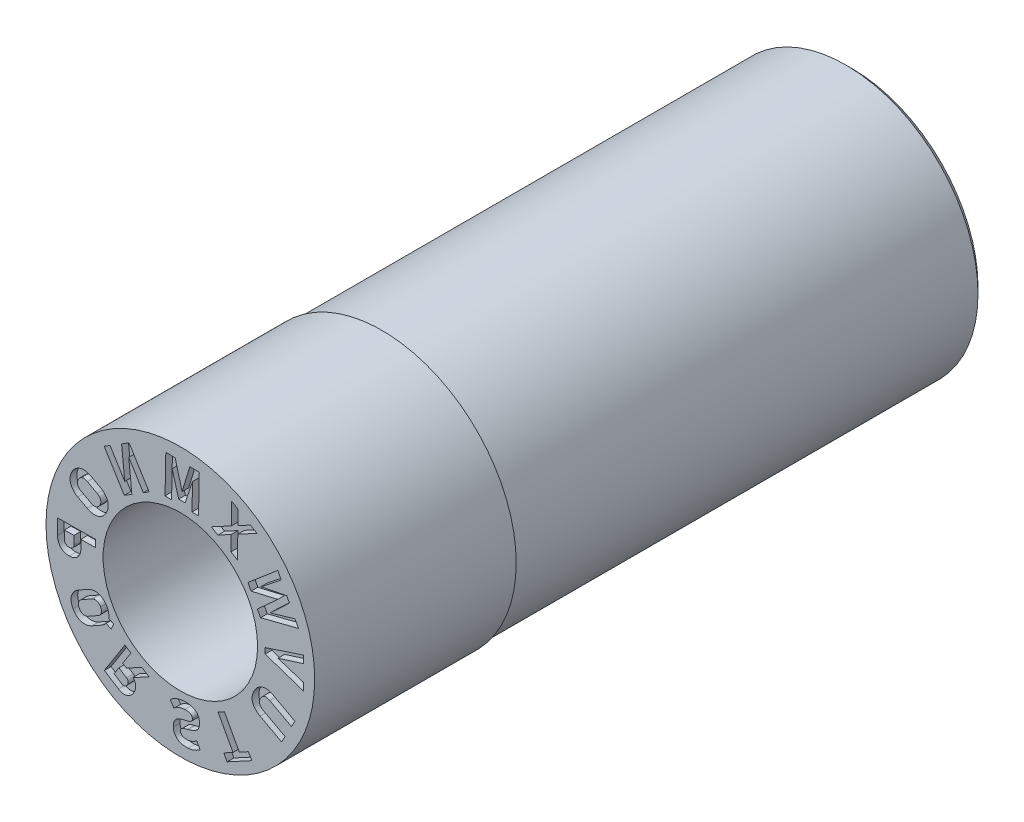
SolidWorks part; units mm, degrees
ref_plane "Front Plane" through (0, 0, 0) normal (0, 0, 1) x (1, 0, 0)
ref_plane "Top Plane" through (0, 0, 0) normal (0, 1, 0) x (1, 0, 0)
ref_plane "Right Plane" through (0, 0, 0) normal (1, 0, 0) x (0, 0, -1)
sketch "Sketch1" plane through (0, 0, 0) normal (1, 0, 0) x (0, 0, -1)
  line L2 (0, 4) -> (0, 2.3)
  line L3 (19.75, 4) -> (0, 4)
  line L4 (-3.7979, 0) -> (49996.2021, 0) construction
  line L8 (16, 1.25) -> (4, 1.25)
  line L9 (4, 2.3) -> (4, 1.25)
  line L10 (4, 2.3) -> (0, 2.3)
  line L12 (20, 2) -> (20, 3.75)
  line L16 (20, 3.75) -> (19.75, 4)
  line L17 (20, 2) -> (16, 2)
  line L18 (16, 1.25) -> (16, 2)
  dimension "D1" = 20
  dimension "D2" = 45
  dimension "D3" = 0.25
  dimension "D4" = 8
  dimension "D5" = 4.6
  dimension "D6" = 4
  dimension "D7" = 2.5
  dimension "D8" = 4
  dimension "D9" = 4
revolve "Revolve1" add sketch "Sketch1" angle 360 about L4
sketch "Sketch4" plane through (0, 0, 0) normal (1, 0, 0) x (0, 0, -1)
  line L0 (0, 0) -> (50000, 0) construction
  line L1 (20, -3.75) -> (20, 3.75) construction
  line L2 (6, 4.935) -> (20, 4.935)
  line L3 (6, 4.935) -> (6, 3.935)
  line L4 (6, 3.935) -> (20, 3.935)
  line L5 (20, 4.935) -> (20, 3.935)
  line L6 (19.75, 4) -> (0, 4) construction
  line L9 (0, 4.4) -> (0, -4.4) construction
  dimension "D1" = 1
  dimension "D2" = 0.065
  dimension "D3" = 6
revolve "Cut-Revolve1" cut sketch "Sketch4" angle 360 about L0
sketch "Sketch2" plane through (0, 0, 0) normal (0, 0, 1) x (1, 0, 0)
  line L0 (0, 0) -> (0, 4) construction
  line L1 (0, 0) -> (2, 3.4641) construction
  line L2 (0, 0) -> (3.4641, 2) construction
  line L3 (0, 0) -> (4, 0) construction
  line L4 (0, 0) -> (3.4641, -2) construction
  line L5 (0, 0) -> (2, -3.4641) construction
  line L6 (0, 0) -> (0, -4) construction
  line L7 (0, 0) -> (-2, -3.4641) construction
  line L8 (0, 0) -> (-3.4641, -2) construction
  line L9 (0, 0) -> (-4, 0) construction
  line L10 (0, 0) -> (-3.4641, 2) construction
  line L11 (0, 0) -> (-2, 3.4641) construction
  line L12 (3.2478, 1.5887) -> (3.169, 1.7412)
  line L13 (3.169, 1.7412) -> (2.3975, 1.5864)
  line L14 (2.3975, 1.5864) -> (3.0025, 2.0634)
  line L15 (3.0025, 2.0634) -> (2.9015, 2.2588)
  line L16 (2.9015, 2.2588) -> (2.014, 1.5057)
  line L17 (2.014, 1.5057) -> (2.1065, 1.327)
  line L18 (2.1065, 1.327) -> (2.9029, 1.5121)
  line L19 (2.9029, 1.5121) -> (2.2957, 0.9612)
  line L20 (2.2957, 0.9612) -> (2.3881, 0.7825)
  line L21 (2.3881, 0.7825) -> (3.5154, 1.0711)
  line L22 (3.5154, 1.0711) -> (3.4144, 1.2665)
  line L23 (3.4144, 1.2665) -> (2.6753, 1.0486)
  line L24 (2.6753, 1.0486) -> (3.2478, 1.5887)
  line L26 (1.7103, 2.5972) -> (2.2805, 2.9042)
  line L27 (2.2805, 2.9042) -> (2.0873, 3.0209)
  line L28 (2.0873, 3.0209) -> (1.7131, 2.8193)
  line L31 (0.9233, 2.3945) -> (1.1171, 2.2779)
  line L32 (1.1171, 2.2779) -> (1.514, 2.4918)
  line L33 (1.7131, 2.8193) -> (1.7187, 3.243)
  line L34 (1.7187, 3.243) -> (1.525, 3.3596)
  line L35 (1.525, 3.3596) -> (1.5168, 2.7134)
  line L36 (1.514, 2.4918) -> (1.5083, 2.0421)
  line L37 (1.5083, 2.0421) -> (1.7019, 1.9254)
  line L38 (1.7019, 1.9254) -> (1.7103, 2.5972)
  line L39 (-0.151, 3.6336) -> (-0.4332, 3.6392)
  line L40 (-0.4332, 3.6392) -> (-0.4552, 2.5035)
  line L41 (-0.4552, 2.5035) -> (-0.2606, 2.4998)
  line L42 (-0.2606, 2.4998) -> (-0.2449, 3.3057)
  line L43 (-2.964, 0.1283) -> (-2.5234, 0.132)
  line L44 (-0.2449, 3.3057) -> (-0.0488, 2.6222)
  line L45 (-0.0488, 2.6222) -> (0.1403, 2.6185)
  line L46 (0.1403, 2.6185) -> (0.3626, 3.2806)
  line L47 (-3.4528, 0.1243) -> (-3.1702, 0.1266)
  line L48 (0.3626, 3.2806) -> (0.3472, 2.4879)
  line L49 (0.3472, 2.4879) -> (0.5417, 2.4842)
  line L50 (0.5417, 2.4842) -> (0.5637, 3.62)
  line L51 (0.5637, 3.62) -> (0.2818, 3.6253)
  line L52 (0.2818, 3.6253) -> (0.0506, 2.8642)
  line L53 (0.0506, 2.8642) -> (-0.151, 3.6336)
  line L54 (-1.5278, 3.3341) -> (-1.7503, 3.1959)
  line L55 (-1.7503, 3.1959) -> (-1.6547, 2.2765)
  line L56 (-1.7164, -2.4432) -> (-1.4707, -2.0578)
  line L57 (-1.6547, 2.2765) -> (-2.0934, 2.9829)
  line L58 (-2.0934, 2.9829) -> (-2.2675, 2.8748)
  line L59 (-2.2675, 2.8748) -> (-1.6685, 1.9102)
  line L60 (-1.6685, 1.9102) -> (-1.4448, 2.0493)
  line L61 (-1.4448, 2.0493) -> (-1.5349, 2.9576)
  line L62 (-1.6068, -2.5131) -> (-1.7164, -2.4432)
  line L63 (-1.5349, 2.9576) -> (-1.1026, 2.2615)
  line L64 (-1.1026, 2.2615) -> (-0.9288, 2.3694)
  line L65 (-0.9288, 2.3694) -> (-1.5278, 3.3341)
  line L66 (-2.3769, 1.7535) -> (-2.66, 1.9063)
  line L67 (-3.054, 1.1763) -> (-2.7709, 1.0234)
  line L68 (-2.6606, 1.2161) -> (-2.9535, 1.3742)
  line L69 (-2.7701, 1.7138) -> (-2.4772, 1.5557)
  line L70 (-3.1702, 0.1266) -> (-3.1682, -0.1202)
  line L71 (-3.4508, -0.1224) -> (-3.4528, 0.1243)
  line L72 (1.5674, -3.1018) -> (1.2946, -3.2497)
  line L73 (-3.6609, 0.3367) -> (-3.6571, -0.1188)
  line L74 (-2.9621, -0.113) -> (-2.964, 0.1283)
  line L75 (1.5168, 2.7134) -> (0.9233, 2.3945)
  line L78 (-2.5234, 0.132) -> (-2.5252, 0.3461)
  line L79 (-2.5252, 0.3461) -> (-3.6609, 0.3367)
  line L81 (-2.211, -1.664) -> (-2.0551, -1.7316)
  line L82 (-2.0551, -1.7316) -> (-1.9848, -1.5618)
  line L83 (-1.9848, -1.5618) -> (-2.1336, -1.4974)
  line L84 (-2.7543, -1.0586) -> (-3.0335, -1.2159)
  line L85 (-2.6283, -1.9351) -> (-2.3491, -1.7779)
  line L86 (-2.4529, -1.5827) -> (-2.7413, -1.7452)
  line L87 (-2.9297, -1.4107) -> (-2.6414, -1.2482)
  line L88 (-1.8273, -2.6171) -> (-1.6027, -2.7604)
  line L89 (-1.7464, -2.9858) -> (-1.971, -2.8425)
  line L91 (-2.2626, -2.9016) -> (-1.8429, -3.1691)
  line L95 (-1.971, -2.8425) -> (-1.8273, -2.6171)
  line L96 (-1.4707, -2.0578) -> (-1.6512, -1.9428)
  line L97 (-1.6512, -1.9428) -> (-2.2626, -2.9016)
  line L99 (-1.4072, -2.6539) -> (-0.9263, -2.4049)
  line L100 (-0.9263, -2.4049) -> (-1.1452, -2.2654)
  line L101 (-1.1452, -2.2654) -> (-1.6068, -2.5131)
  line L102 (-0.3006, -2.6698) -> (-0.1912, -2.8404)
  line L103 (0.358, -2.8323) -> (0.358, -2.833)
  line L104 (0.1582, -2.98) -> (0.1411, -2.9834)
  line L105 (-0.2083, -3.3355) -> (-0.2082, -3.3364)
  line L106 (0.588, -3.5207) -> (0.487, -3.3448)
  line L107 (0.0053, -3.3443) -> (0.0053, -3.3436)
  line L108 (0.5706, -2.8257) -> (0.5707, -2.824)
  line L110 (1.756, -2.9995) -> (1.3119, -2.1801)
  line L111 (1.3119, -2.1801) -> (1.1233, -2.2823)
  line L112 (1.1233, -2.2823) -> (1.5674, -3.1018)
  line L113 (1.3931, -3.4315) -> (2.1273, -3.0336)
  line L114 (2.1273, -3.0336) -> (2.0287, -2.8518)
  line L115 (2.0287, -2.8518) -> (1.756, -2.9995)
  line L116 (1.2946, -3.2497) -> (1.3931, -3.4315)
  line L117 (2.3753, -1.7607) -> (3.0147, -2.1065)
  line L118 (3.0147, -2.1065) -> (3.1167, -1.9178)
  line L119 (3.1167, -1.9178) -> (2.4724, -1.5694)
  line L120 (2.664, -1.2153) -> (3.3083, -1.5638)
  line L121 (3.3083, -1.5638) -> (3.4104, -1.3751)
  line L122 (3.4104, -1.3751) -> (2.771, -1.0292)
  line L123 (3.6619, -0.4666) -> (3.6626, -0.2463)
  line L124 (3.6626, -0.2463) -> (2.9056, -0.0029)
  line L125 (2.9056, -0.0029) -> (3.6637, 0.2363)
  line L126 (3.6637, 0.2363) -> (3.6644, 0.4566)
  line L127 (3.6644, 0.4566) -> (2.5277, 0.0818)
  line L128 (2.5277, 0.0818) -> (2.5272, -0.0855)
  line L129 (2.5272, -0.0855) -> (3.6619, -0.4666)
  circle A0 centre (0, 0) radius 2.5697 construction
  circle A1 centre (0, 0) radius 4 construction
  spline S0 degree 3 poles (-2.2052, 1.1896) (-2.1958, 1.2073) (-2.1831, 1.2341) (-2.1695, 1.2707) (-2.1614, 1.2977) (-2.1551, 1.3248) (-2.1506, 1.3518) (-2.1479, 1.3788) (-2.1474, 1.4057) (-2.1485, 1.4323) (-2.1514, 1.4584) (-2.1562, 1.484) (-2.1629, 1.509) (-2.1713, 1.5336) (-2.1814, 1.5576) (-2.1935, 1.5811) (-2.2074, 1.6039) (-2.223, 1.6261) (-2.2402, 1.6472) (-2.259, 1.6674) (-2.2794, 1.6867) (-2.3014, 1.7051) (-2.3335, 1.7281) (-2.3591, 1.7438) (-2.3769, 1.7535) knots 0 0 0 0 0.090475 0.133833 0.176138 0.218046 0.259239 0.299899 0.340503 0.38067 0.420105 0.459006 0.497913 0.537136 0.576103 0.615708 0.656162 0.696964 0.737956 0.779326 0.821594 0.864592 0.908608 1 1 1 1
  spline S1 degree 3 poles (-2.66, 1.9063) (-2.6778, 1.916) (-2.7049, 1.929) (-2.742, 1.9425) (-2.7693, 1.951) (-2.7966, 1.9575) (-2.8238, 1.9622) (-2.8509, 1.965) (-2.8779, 1.9657) (-2.9046, 1.9649) (-2.9308, 1.9619) (-2.9565, 1.9571) (-2.9817, 1.9511) (-3.0062, 1.9426) (-3.0303, 1.9327) (-3.0538, 1.9209) (-3.0766, 1.9073) (-3.0987, 1.8921) (-3.1198, 1.8751) (-3.1401, 1.8567) (-3.159, 1.8363) (-3.1772, 1.8148) (-3.2005, 1.7834) (-3.2156, 1.7578) (-3.2253, 1.7404) knots 0 0 0 0 0.091587 0.13545 0.17853 0.220707 0.262153 0.303049 0.343867 0.384229 0.42368 0.463053 0.50187 0.540771 0.580159 0.619472 0.659607 0.700066 0.740693 0.782021 0.823629 0.866209 0.909671 1 1 1 1
  spline S2 degree 3 poles (-3.2253, 1.7404) (-3.2347, 1.7227) (-3.2475, 1.6959) (-3.2609, 1.6592) (-3.2694, 1.6323) (-3.2754, 1.6051) (-3.2799, 1.5782) (-3.2826, 1.5512) (-3.2831, 1.5243) (-3.282, 1.4977) (-3.279, 1.4715) (-3.2745, 1.4458) (-3.2676, 1.4208) (-3.2594, 1.3962) (-3.2492, 1.3722) (-3.2371, 1.3487) (-3.2233, 1.3259) (-3.2077, 1.3038) (-3.1905, 1.2826) (-3.1716, 1.2625) (-3.1516, 1.2429) (-3.1292, 1.225) (-3.0975, 1.2015) (-3.0718, 1.186) (-3.054, 1.1763) knots 0 0 0 0 0.090473 0.133829 0.1764 0.218055 0.259247 0.299906 0.340509 0.380675 0.420108 0.459465 0.49837 0.537255 0.576563 0.616167 0.656272 0.697072 0.738063 0.779432 0.82162 0.86472 0.908611 1 1 1 1
  spline S3 degree 3 poles (-2.7709, 1.0234) (-2.7531, 1.0138) (-2.726, 1.0008) (-2.6889, 0.9872) (-2.6616, 0.9788) (-2.6343, 0.9723) (-2.6071, 0.9675) (-2.5799, 0.9649) (-2.5528, 0.9641) (-2.5261, 0.9651) (-2.4998, 0.9678) (-2.4741, 0.9725) (-2.449, 0.9789) (-2.4243, 0.987) (-2.4003, 0.9973) (-2.3768, 1.009) (-2.3539, 1.0227) (-2.3318, 1.038) (-2.3107, 1.0549) (-2.2905, 1.0734) (-2.2713, 1.0934) (-2.2534, 1.1153) (-2.2299, 1.1466) (-2.215, 1.1722) (-2.2052, 1.1896) knots 0 0 0 0 0.091523 0.135355 0.178405 0.220553 0.26197 0.303107 0.343897 0.384231 0.423812 0.463158 0.501833 0.541132 0.580087 0.619718 0.659825 0.700256 0.740854 0.782153 0.823651 0.866303 0.909734 1 1 1 1
  spline S4 degree 3 poles (-2.3937, 1.2914) (-2.4023, 1.2753) (-2.4175, 1.253) (-2.4429, 1.2283) (-2.4632, 1.2133) (-2.4851, 1.2015) (-2.5081, 1.193) (-2.5323, 1.1882) (-2.5573, 1.1867) (-2.5831, 1.1888) (-2.6186, 1.1962) (-2.6441, 1.2072) (-2.6606, 1.2161) knots 0 0 0 0 0.175119 0.257326 0.338171 0.416955 0.495278 0.572703 0.652986 0.735347 0.820181 1 1 1 1
  spline S5 degree 3 poles (-2.9535, 1.3742) (-2.9702, 1.3828) (-2.993, 1.3986) (-3.0188, 1.4239) (-3.0347, 1.4443) (-3.0474, 1.4661) (-3.0565, 1.4891) (-3.0626, 1.513) (-3.0644, 1.5377) (-3.0631, 1.5629) (-3.0562, 1.5976) (-3.0458, 1.6226) (-3.0372, 1.6387) knots 0 0 0 0 0.179549 0.264319 0.346737 0.426788 0.505309 0.58302 0.662167 0.742098 0.824788 1 1 1 1
  spline S6 degree 3 poles (-3.0372, 1.6387) (-3.0283, 1.6545) (-3.0135, 1.6771) (-2.9882, 1.7016) (-2.9678, 1.7166) (-2.946, 1.7286) (-2.9228, 1.7367) (-2.8985, 1.7417) (-2.8734, 1.7431) (-2.8477, 1.7411) (-2.8123, 1.7333) (-2.7866, 1.7227) (-2.7701, 1.7138) knots 0 0 0 0 0.17437 0.256578 0.337423 0.416207 0.494702 0.572815 0.653099 0.73546 0.819773 1 1 1 1
  spline S7 degree 3 poles (-2.4772, 1.5557) (-2.4605, 1.547) (-2.4378, 1.5312) (-2.4118, 1.5059) (-2.396, 1.4855) (-2.3832, 1.4638) (-2.3744, 1.4407) (-2.3685, 1.4169) (-2.3667, 1.3922) (-2.3677, 1.3669) (-2.3747, 1.3323) (-2.385, 1.3073) (-2.3937, 1.2914) knots 0 0 0 0 0.180401 0.264533 0.347036 0.427169 0.505921 0.583014 0.662241 0.742853 0.825627 1 1 1 1
  spline S8 degree 3 poles (-3.1682, -0.1202) (-3.168, -0.1324) (-3.1699, -0.1503) (-3.177, -0.1728) (-3.1849, -0.188) (-3.1942, -0.2021) (-3.2059, -0.2145) (-3.2191, -0.2255) (-3.2344, -0.2344) (-3.2508, -0.242) (-3.2753, -0.2488) (-3.2945, -0.2513) (-3.3077, -0.251) knots 0 0 0 0 0.169702 0.249373 0.32835 0.407202 0.484869 0.56457 0.646564 0.730961 0.81689 1 1 1 1
  spline S9 degree 3 poles (-3.3077, -0.251) (-3.3209, -0.2509) (-3.3406, -0.2499) (-3.3654, -0.2429) (-3.3824, -0.2362) (-3.3977, -0.2272) (-3.4115, -0.2169) (-3.4231, -0.2045) (-3.4332, -0.1909) (-3.4408, -0.1756) (-3.4485, -0.153) (-3.4508, -0.1348) (-3.4508, -0.1224) knots 0 0 0 0 0.183852 0.270698 0.355396 0.436349 0.515407 0.592492 0.670707 0.74904 0.828744 1 1 1 1
  spline S10 degree 3 poles (-3.6571, -0.1188) (-3.6567, -0.1523) (-3.6517, -0.2017) (-3.6326, -0.2637) (-3.6133, -0.3057) (-3.5891, -0.3438) (-3.5602, -0.3775) (-3.527, -0.4067) (-3.4893, -0.4308) (-3.448, -0.4501) (-3.3871, -0.4688) (-3.3385, -0.4728) (-3.3057, -0.4728) knots 0 0 0 0 0.179221 0.263356 0.3453 0.425606 0.503765 0.581676 0.661013 0.742125 0.824503 1 1 1 1
  spline S11 degree 3 poles (-3.3057, -0.4728) (-3.273, -0.4724) (-3.2246, -0.4674) (-3.1644, -0.4476) (-3.1237, -0.4276) (-3.0865, -0.4029) (-3.0539, -0.3732) (-3.0259, -0.3389) (-3.0026, -0.3004) (-2.9839, -0.2582) (-2.9661, -0.196) (-2.9621, -0.1465) (-2.9621, -0.113) knots 0 0 0 0 0.175635 0.257845 0.338627 0.417828 0.496 0.573988 0.654233 0.736138 0.820444 1 1 1 1
  spline S12 degree 3 poles (-2.1888, -1.2137) (-2.1985, -1.1963) (-2.2146, -1.1716) (-2.2379, -1.1405) (-2.2564, -1.1193) (-2.2758, -1.0997) (-2.2962, -1.0817) (-2.3176, -1.0653) (-2.3398, -1.0505) (-2.363, -1.0374) (-2.3864, -1.0258) (-2.4105, -1.0162) (-2.4351, -1.0085) (-2.4602, -1.0026) (-2.4859, -0.9984) (-2.5121, -0.9963) (-2.5387, -0.9956) (-2.5655, -0.9971) (-2.5925, -0.9999) (-2.6194, -1.0054) (-2.6465, -1.0119) (-2.6734, -1.0212) (-2.7102, -1.0351) (-2.7367, -1.0488) (-2.7543, -1.0586) knots 0 0 0 0 0.090308 0.133907 0.176133 0.217948 0.259196 0.299712 0.340384 0.380355 0.420139 0.459255 0.497924 0.53704 0.576475 0.616123 0.656328 0.697151 0.738088 0.779503 0.821628 0.864655 0.908667 1 1 1 1
  spline S13 degree 3 poles (-3.0335, -1.2159) (-3.0512, -1.2256) (-3.0761, -1.242) (-3.1078, -1.2654) (-3.1293, -1.2841) (-3.1492, -1.3036) (-3.1676, -1.324) (-3.1842, -1.3455) (-3.1993, -1.3678) (-3.2127, -1.3907) (-3.2241, -1.4143) (-3.2342, -1.4383) (-3.2418, -1.4629) (-3.248, -1.4879) (-3.2522, -1.5134) (-3.255, -1.5395) (-3.2554, -1.566) (-3.2544, -1.5927) (-3.2511, -1.6194) (-3.2464, -1.6462) (-3.2393, -1.6729) (-3.2308, -1.6998) (-3.2166, -1.7359) (-3.2039, -1.7626) (-3.1938, -1.7797) knots 0 0 0 0 0.091548 0.135593 0.178585 0.220816 0.262118 0.303361 0.344039 0.384343 0.423771 0.463168 0.502171 0.540838 0.580134 0.619464 0.659662 0.70028 0.740935 0.781872 0.823746 0.866231 0.909745 1 1 1 1
  spline S14 degree 3 poles (-3.1938, -1.7797) (-3.1838, -1.7969) (-3.1685, -1.8222) (-3.1446, -1.8529) (-3.1264, -1.8743) (-3.1069, -1.8939) (-3.0865, -1.9118) (-3.0653, -1.9286) (-3.043, -1.9433) (-3.0199, -1.9564) (-2.9964, -1.9679) (-2.9723, -1.9777) (-2.9476, -1.985) (-2.9226, -1.9913) (-2.897, -1.9954) (-2.8708, -1.9975) (-2.8442, -1.9982) (-2.8173, -1.9968) (-2.7903, -1.9935) (-2.7632, -1.9888) (-2.7363, -1.9814) (-2.7091, -1.973) (-2.6728, -1.958) (-2.6457, -1.9453) (-2.6283, -1.9351) knots 0 0 0 0 0.090397 0.133844 0.176483 0.217932 0.259155 0.299684 0.340331 0.380278 0.420037 0.459129 0.4982 0.536851 0.576261 0.615885 0.656066 0.696863 0.737992 0.779405 0.821513 0.864474 0.908529 1 1 1 1
  spline S15 degree 3 poles (-2.3491, -1.7779) (-2.3315, -1.7681) (-2.3063, -1.7519) (-2.275, -1.7281) (-2.2536, -1.7096) (-2.2336, -1.6901) (-2.2198, -1.6746) (-2.2125, -1.6658) (-2.211, -1.664) knots 0 0 0 0 0.091541 0.135456 0.178445 0.220333 0.261976 0.272511 0.272511 0.272511 0.272511
  spline S16 degree 3 poles (-2.3744, -1.3182) (-2.3653, -1.334) (-2.3549, -1.3588) (-2.3475, -1.3931) (-2.3458, -1.4182) (-2.3472, -1.4429) (-2.3526, -1.4667) (-2.3612, -1.4896) (-2.3734, -1.5115) (-2.3888, -1.5321) (-2.4141, -1.5577) (-2.4365, -1.5739) (-2.4529, -1.5827) knots 0 0 0 0 0.175359 0.257515 0.338095 0.417367 0.494599 0.57272 0.653217 0.735455 0.820169 1 1 1 1
  spline S17 degree 3 poles (-2.7413, -1.7452) (-2.7575, -1.7546) (-2.783, -1.7654) (-2.8182, -1.7737) (-2.8438, -1.7763) (-2.8688, -1.7754) (-2.8928, -1.7707) (-2.916, -1.7632) (-2.9379, -1.7517) (-2.9585, -1.7373) (-2.9837, -1.7128) (-2.9997, -1.6912) (-3.0083, -1.6752) knots 0 0 0 0 0.18072 0.265411 0.347689 0.427965 0.505195 0.583145 0.662223 0.742733 0.824876 1 1 1 1
  spline S18 degree 3 poles (-3.0083, -1.6752) (-3.0171, -1.6593) (-3.0282, -1.6347) (-3.0354, -1.6003) (-3.0372, -1.5753) (-3.0354, -1.5506) (-3.0304, -1.5267) (-3.0217, -1.5037) (-3.0096, -1.4819) (-2.9942, -1.4614) (-2.9689, -1.4356) (-2.946, -1.4199) (-2.9297, -1.4107) knots 0 0 0 0 0.175313 0.257397 0.337906 0.416761 0.494873 0.572924 0.652607 0.734772 0.819412 1 1 1 1
  spline S19 degree 3 poles (-2.6414, -1.2482) (-2.625, -1.2393) (-2.5999, -1.2276) (-2.5647, -1.2198) (-2.5392, -1.2172) (-2.5141, -1.2181) (-2.49, -1.2225) (-2.4669, -1.2304) (-2.4451, -1.2417) (-2.4245, -1.2563) (-2.3987, -1.2803) (-2.3836, -1.3027) (-2.3744, -1.3182) knots 0 0 0 0 0.1803 0.264511 0.34683 0.427147 0.505377 0.582473 0.661591 0.742141 0.824903 1 1 1 1
  spline S20 degree 3 poles (-1.6027, -2.7604) (-1.594, -2.7661) (-1.5817, -2.7757) (-1.5696, -2.7921) (-1.5624, -2.8052) (-1.5574, -2.8193) (-1.5543, -2.8342) (-1.5537, -2.8499) (-1.5551, -2.8661) (-1.5585, -2.8828) (-1.5661, -2.9056) (-1.5744, -2.9221) (-1.5809, -2.9328) knots 0 0 0 0 0.160556 0.236529 0.312594 0.389213 0.465583 0.546398 0.630137 0.716407 0.807127 1 1 1 1
  spline S21 degree 3 poles (-1.5809, -2.9328) (-1.588, -2.9432) (-1.5987, -2.9584) (-1.6165, -2.9747) (-1.6299, -2.9851) (-1.6441, -2.9929) (-1.6584, -2.9991) (-1.6731, -3.0025) (-1.6881, -3.0039) (-1.703, -3.0028) (-1.7232, -2.9984) (-1.7373, -2.9913) (-1.7464, -2.9858) knots 0 0 0 0 0.193022 0.282997 0.369659 0.45265 0.53105 0.607759 0.684303 0.760277 0.836867 1 1 1 1
  spline S22 degree 3 poles (-1.8429, -3.1691) (-1.8178, -3.1849) (-1.7784, -3.2047) (-1.7227, -3.219) (-1.6813, -3.2233) (-1.6403, -3.2218) (-1.6, -3.2142) (-1.5609, -3.201) (-1.5232, -3.1817) (-1.4873, -3.1569) (-1.4411, -3.116) (-1.4125, -3.0782) (-1.395, -3.0514) knots 0 0 0 0 0.170698 0.250923 0.330225 0.408887 0.486576 0.565054 0.645851 0.729606 0.815425 1 1 1 1
  spline S23 degree 3 poles (-1.395, -3.0514) (-1.3779, -3.0244) (-1.3561, -2.9824) (-1.3383, -2.9235) (-1.3314, -2.8804) (-1.3298, -2.838) (-1.3341, -2.7968) (-1.3445, -2.7571) (-1.3606, -2.7193) (-1.3816, -2.6845) (-1.3984, -2.6635) (-1.4072, -2.6539) knots 0 0 0 0 0.184209 0.270005 0.353629 0.43476 0.513647 0.591381 0.670203 0.749943 0.824656 0.824656 0.824656 0.824656
  spline S24 degree 3 poles (0.1182, -2.5046) (0.0913, -2.5058) (0.0515, -2.5106) (-0.001, -2.5202) (-0.0395, -2.5299) (-0.0771, -2.5411) (-0.1137, -2.5542) (-0.149, -2.5692) (-0.1828, -2.5863) (-0.2151, -2.6046) (-0.2553, -2.6312) (-0.2833, -2.6537) (-0.3006, -2.6698) knots 0 0 0 0 0.175587 0.262118 0.348707 0.434465 0.519112 0.602542 0.685065 0.766128 0.845758 1 1 1 1
  spline S25 degree 3 poles (-0.1912, -2.8404) (-0.1704, -2.8209) (-0.1357, -2.7951) (-0.0853, -2.7663) (-0.0447, -2.7482) (-0.0025, -2.7328) (0.0554, -2.7172) (0.1001, -2.711) (0.13, -2.7093) knots 0 0 0 0 0.241702 0.365363 0.491604 0.619061 0.745694 1 1 1 1
  spline S26 degree 3 poles (0.13, -2.7093) (0.1465, -2.7081) (0.1706, -2.7079) (0.2018, -2.7096) (0.2231, -2.7123) (0.2431, -2.7163) (0.2616, -2.7214) (0.2789, -2.7274) (0.2945, -2.735) (0.3088, -2.7433) (0.321, -2.7532) (0.3318, -2.7636) (0.3404, -2.7756) (0.3477, -2.7882) (0.3551, -2.8068) (0.3571, -2.8221) (0.358, -2.8323) knots 0 0 0 0 0.170595 0.248996 0.322696 0.39282 0.458721 0.521499 0.581267 0.638207 0.691781 0.743346 0.793403 0.843039 0.893539 1 1 1 1
  spline S27 degree 3 poles (0.358, -2.833) (0.3591, -2.8467) (0.3571, -2.867) (0.3476, -2.8915) (0.3369, -2.9069) (0.3234, -2.92) (0.3081, -2.9318) (0.2907, -2.9416) (0.2711, -2.95) (0.249, -2.9572) (0.2143, -2.9673) (0.1864, -2.9737) (0.1669, -2.9779) knots 0 0 0 0 0.155433 0.226358 0.294959 0.365573 0.437141 0.512416 0.590942 0.677592 0.774135 1 1 1 1
  spline S28 degree 3 poles (0.1669, -2.9779) (0.1655, -2.9784) (0.1626, -2.9793) (0.1596, -2.9792) (0.1582, -2.98) knots 0 0 0 0 0.50072 1 1 1 1
  spline S29 degree 3 poles (0.1411, -2.9834) (0.1064, -2.9906) (0.0571, -3.0032) (-0.0047, -3.0231) (-0.0446, -3.0382) (-0.0808, -3.0563) (-0.113, -3.0798) (-0.1423, -3.1079) (-0.1636, -3.1352) (-0.1785, -3.1595) (-0.1882, -3.1797) (-0.1957, -3.2017) (-0.2021, -3.2252) (-0.206, -3.2505) (-0.2096, -3.2873) (-0.2091, -3.3159) (-0.2083, -3.3355) knots 0 0 0 0 0.190443 0.273606 0.348893 0.419697 0.490506 0.562626 0.637449 0.67595 0.715796 0.757554 0.801013 0.846607 0.894857 1 1 1 1
  spline S30 degree 3 poles (-0.2082, -3.3364) (-0.2073, -3.3541) (-0.204, -3.3801) (-0.1973, -3.414) (-0.1902, -3.4377) (-0.1823, -3.4605) (-0.1722, -3.482) (-0.1611, -3.5026) (-0.1483, -3.522) (-0.1343, -3.5402) (-0.1188, -3.5572) (-0.102, -3.573) (-0.0839, -3.5874) (-0.0645, -3.6006) (-0.0438, -3.6127) (-0.0216, -3.6234) (0.0017, -3.6329) (0.0264, -3.641) (0.0522, -3.6478) (0.0791, -3.6535) (0.1071, -3.6575) (0.1363, -3.6603) (0.1775, -3.6623) (0.2091, -3.6619) (0.2304, -3.6605) knots 0 0 0 0 0.086085 0.127066 0.166982 0.205904 0.244231 0.281955 0.319432 0.356388 0.393572 0.430698 0.467995 0.505689 0.544523 0.584174 0.624839 0.666695 0.709908 0.754272 0.799817 0.847135 0.896337 1 1 1 1
  spline S31 degree 3 poles (0.2304, -3.6605) (0.251, -3.6592) (0.282, -3.6558) (0.3231, -3.6474) (0.3649, -3.637) (0.4167, -3.6194) (0.4971, -3.5835) (0.5533, -3.548) (0.588, -3.5207) knots 0 0 0 0 0.158702 0.239875 0.322725 0.490797 0.660273 1 1 1 1
  spline S32 degree 3 poles (0.487, -3.3448) (0.4665, -3.3609) (0.4344, -3.383) (0.3891, -3.4076) (0.3548, -3.4236) (0.3202, -3.4364) (0.2752, -3.4494) (0.241, -3.4544) (0.2186, -3.4561) knots 0 0 0 0 0.265378 0.395586 0.524196 0.649875 0.77108 1 1 1 1
  spline S33 degree 3 poles (0.2186, -3.4561) (0.2031, -3.457) (0.1805, -3.4573) (0.1512, -3.4557) (0.1312, -3.453) (0.1126, -3.4497) (0.0952, -3.4453) (0.0793, -3.4393) (0.0646, -3.4328) (0.0513, -3.4251) (0.0397, -3.4163) (0.0297, -3.4066) (0.0216, -3.3959) (0.015, -3.3843) (0.008, -3.3675) (0.006, -3.3536) (0.0053, -3.3443) knots 0 0 0 0 0.172706 0.252007 0.327088 0.397011 0.463128 0.526196 0.585922 0.642502 0.696644 0.747946 0.797348 0.846237 0.895489 1 1 1 1
  spline S34 degree 3 poles (0.0053, -3.3436) (0.0042, -3.3287) (0.006, -3.3067) (0.0168, -3.2802) (0.0286, -3.264) (0.0428, -3.2498) (0.0588, -3.2374) (0.0766, -3.2268) (0.0968, -3.218) (0.1197, -3.21) (0.1577, -3.1975) (0.1888, -3.1898) (0.2107, -3.1837) knots 0 0 0 0 0.156391 0.227185 0.295825 0.36579 0.436118 0.507261 0.582046 0.665244 0.761811 1 1 1 1
  spline S35 degree 3 poles (0.2107, -3.1837) (0.2127, -3.183) (0.217, -3.1827) (0.221, -3.1812) (0.2232, -3.1808) knots 0 0 0 0 0.490112 1 1 1 1
  spline S36 degree 3 poles (0.2232, -3.1808) (0.2262, -3.1802) (0.232, -3.1783) (0.2378, -3.1763) (0.2408, -3.1757) knots 0 0 0 0 0.5 1 1 1 1
  spline S37 degree 3 poles (0.2408, -3.1757) (0.2736, -3.167) (0.3207, -3.1539) (0.3792, -3.1318) (0.4174, -3.1154) (0.452, -3.096) (0.4825, -3.0717) (0.51, -3.0434) (0.53, -3.0164) (0.5436, -2.9925) (0.5523, -2.9729) (0.5594, -2.9518) (0.5651, -2.9293) (0.5687, -2.9054) (0.5719, -2.8707) (0.5716, -2.8439) (0.5706, -2.8257) knots 0 0 0 0 0.189719 0.273147 0.349847 0.422104 0.494063 0.567278 0.642438 0.681118 0.720944 0.762269 0.805408 0.850527 0.897586 1 1 1 1
  spline S38 degree 3 poles (0.5707, -2.824) (0.5699, -2.8065) (0.5665, -2.7808) (0.5594, -2.7476) (0.5527, -2.7241) (0.5439, -2.7019) (0.5342, -2.6804) (0.5224, -2.6603) (0.5095, -2.641) (0.4951, -2.6229) (0.479, -2.6061) (0.4617, -2.5905) (0.4428, -2.5764) (0.4227, -2.5632) (0.4013, -2.5512) (0.3784, -2.5408) (0.3542, -2.5315) (0.3287, -2.5234) (0.3021, -2.5166) (0.2743, -2.5111) (0.2452, -2.5072) (0.2151, -2.5045) (0.1726, -2.5026) (0.1401, -2.5031) (0.1182, -2.5046) knots 0 0 0 0 0.083805 0.123524 0.162524 0.200379 0.237827 0.274983 0.311786 0.348624 0.385443 0.422789 0.460113 0.498138 0.537335 0.577193 0.618603 0.661229 0.704881 0.750038 0.796743 0.844853 0.894833 1 1 1 1
  spline S39 degree 3 poles (2.1998, -1.1939) (2.1898, -1.2126) (2.1759, -1.2406) (2.1615, -1.279) (2.1522, -1.3067) (2.1456, -1.3344) (2.1405, -1.3616) (2.1374, -1.3885) (2.1364, -1.4151) (2.1375, -1.4413) (2.1397, -1.467) (2.1448, -1.4921) (2.1512, -1.5167) (2.16, -1.5406) (2.1699, -1.5642) (2.1827, -1.5869) (2.1968, -1.6092) (2.2127, -1.6309) (2.2307, -1.6517) (2.2504, -1.6718) (2.2718, -1.6914) (2.2951, -1.7099) (2.3292, -1.734) (2.3564, -1.7504) (2.3753, -1.7607) knots 0 0 0 0 0.094079 0.138735 0.182121 0.224093 0.265094 0.305054 0.344445 0.383205 0.421398 0.4591 0.496952 0.534303 0.572191 0.6107 0.649799 0.689654 0.730154 0.771787 0.814712 0.858852 0.90426 1 1 1 1
  spline S40 degree 3 poles (2.4724, -1.5694) (2.4589, -1.562) (2.4396, -1.55) (2.4169, -1.5312) (2.402, -1.5171) (2.3896, -1.5015) (2.3788, -1.4855) (2.3701, -1.4686) (2.3634, -1.4509) (2.3587, -1.4327) (2.3564, -1.414) (2.3561, -1.395) (2.3579, -1.3757) (2.3619, -1.3559) (2.3701, -1.3283) (2.3795, -1.3082) (2.3867, -1.2949) knots 0 0 0 0 0.141711 0.207088 0.270287 0.330096 0.388861 0.447189 0.504398 0.561935 0.619249 0.676807 0.736293 0.797374 0.861646 1 1 1 1
  spline S41 degree 3 poles (2.3867, -1.2949) (2.3938, -1.2816) (2.4059, -1.2628) (2.4243, -1.2404) (2.439, -1.2264) (2.4541, -1.2138) (2.4704, -1.2037) (2.4874, -1.1954) (2.5052, -1.1892) (2.5236, -1.185) (2.5426, -1.1831) (2.5619, -1.183) (2.5817, -1.1852) (2.6017, -1.1899) (2.6299, -1.1983) (2.6504, -1.2081) (2.664, -1.2153) knots 0 0 0 0 0.138736 0.203009 0.264863 0.32447 0.382332 0.439917 0.497247 0.554394 0.612139 0.670855 0.731024 0.79339 0.858978 1 1 1 1
  spline S42 degree 3 poles (2.771, -1.0292) (2.7522, -1.0187) (2.7233, -1.0054) (2.6846, -0.9898) (2.6562, -0.9805) (2.6282, -0.9734) (2.6006, -0.9678) (2.5733, -0.9646) (2.5463, -0.9629) (2.5199, -0.9632) (2.4939, -0.9656) (2.4685, -0.9699) (2.4437, -0.976) (2.4195, -0.9838) (2.3959, -0.9939) (2.3729, -1.0058) (2.3505, -1.0195) (2.3287, -1.0349) (2.3079, -1.0523) (2.2877, -1.0714) (2.2685, -1.0925) (2.2499, -1.1152) (2.2259, -1.1485) (2.2099, -1.1753) (2.1998, -1.1939) knots 0 0 0 0 0.095623 0.141032 0.185088 0.227969 0.269371 0.30996 0.34988 0.389108 0.427391 0.465421 0.503098 0.540632 0.57851 0.616697 0.655396 0.694803 0.735143 0.7759 0.817999 0.861521 0.905961 1 1 1 1
  spline S43 degree 3 poles (-2.1336, -1.4974) (-2.1326, -1.4918) (-2.1303, -1.4775) (-2.1279, -1.4543) (-2.1275, -1.4278) (-2.1286, -1.401) (-2.1316, -1.3742) (-2.1366, -1.3474) (-2.143, -1.3205) (-2.1519, -1.2937) (-2.1659, -1.2574) (-2.1792, -1.231) (-2.1888, -1.2137) knots 0.553405 0.553405 0.553405 0.553405 0.579646 0.618973 0.659169 0.699784 0.740711 0.781645 0.82351 0.866258 0.909769 1 1 1 1
  point P19 (0, 0)
  point P668 (0, 0.0063)
  point P669 (0.0063, 0.0063)
  point P670 (0.0063, 0)
  dimension "D1" = 12
extrude "Cut-Extrude1" cut sketch "Sketch2" against normal blind 0.2
sketch "Sketch3" plane through (0, 0, -4) normal (0, 0, 1) x (1, 0, 0)
  line L0 (0, 0) -> (0, 50000) construction
  line L1 (0.7217, 1.25) -> (-0.7217, 1.25)
  line L2 (-0.7217, 1.25) -> (-1.4434, 0)
  line L3 (-1.4434, 0) -> (-0.7217, -1.25)
  line L4 (-0.7217, -1.25) -> (0.7217, -1.25)
  line L5 (0.7217, -1.25) -> (1.4434, 0)
  line L6 (1.4434, 0) -> (0.7217, 1.25)
  line L7 (0, 0) -> (50000, 0) construction
  circle A0 centre (0, 0) radius 1.25 construction
  circle A1 centre (0, 0) radius 1.25 construction
extrude "Cut-Extrude2" cut sketch "Sketch3" against normal blind 2
